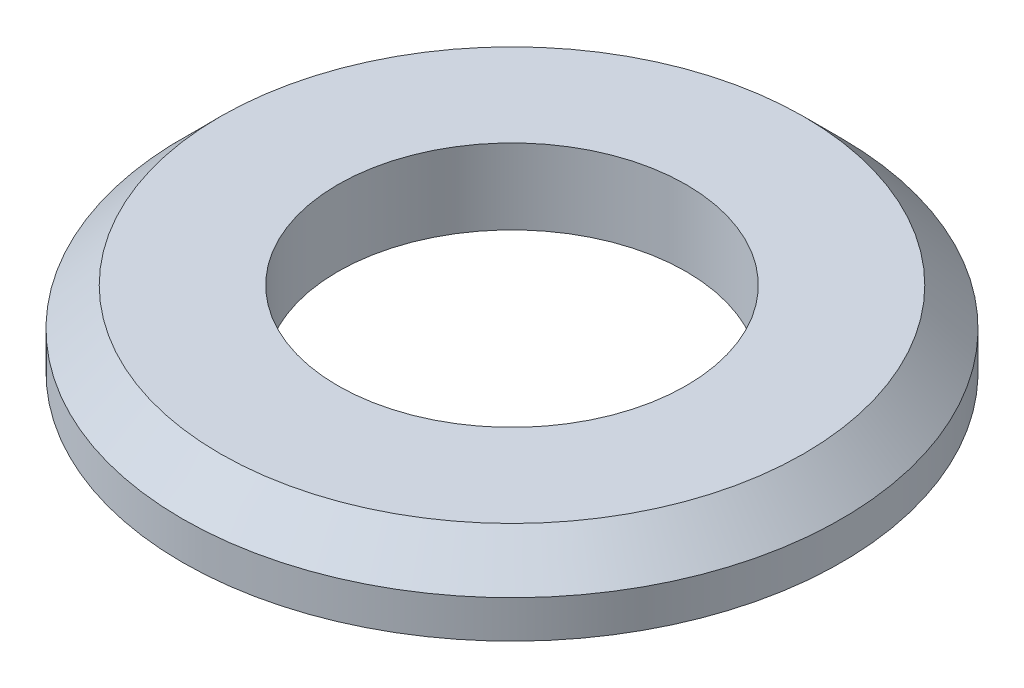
SolidWorks part; units mm, degrees
ref_plane "Front" through (0, 0, 0) normal (0, 0, 1) x (1, 0, 0)
ref_plane "Top" through (0, 0, 0) normal (0, 1, 0) x (1, 0, 0)
ref_plane "Right" through (0, 0, 0) normal (1, 0, 0) x (0, 0, -1)
sketch "Sketch1" plane through (0, 0, 0) normal (0, 1, 0) x (1, 0, 0)
  circle A0 centre (0, 0) radius 3.7
  circle A1 centre (0, 0) radius 7
extrude "Extrude1" add sketch "Sketch1" along normal blind 1.6
chamfer "Chamfer1" distance 0.8 1 edges at (0, 1.6, 7)
